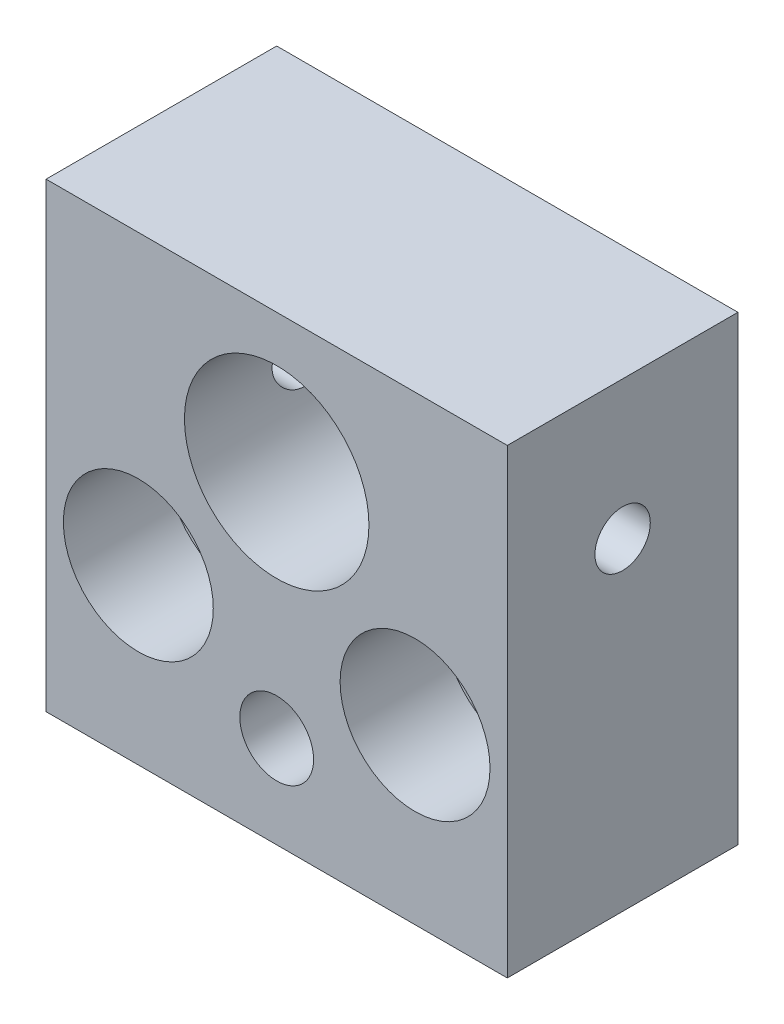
SolidWorks part; units mm, degrees
ref_plane "Face" through (0, 0, 0) normal (0, 0, 1) x (1, 0, 0)
ref_plane "Dessus" through (0, 0, 0) normal (0, 1, 0) x (1, 0, 0)
ref_plane "Droite" through (0, 0, 0) normal (1, 0, 0) x (0, 0, -1)
sketch "Esquisse1" plane through (0, 0, 0) normal (0, 0, 1) x (1, 0, 0)
  line L1 (-10, 38.5) -> (10, 38.5)
  line L2 (-10, 38.5) -> (-10, 18.5)
  line L3 (-10, 18.5) -> (10, 18.5)
  line L4 (10, 38.5) -> (10, 18.5)
  arc A0 (2, 27.9174) -> (-2, 27.9174) centre (0, 32.5) ccw construction
  circle A1 centre (0, 32.5) radius 4
  dimension "D3" = 10
  dimension "D5" = 8
  dimension "D1" = 6
  dimension "D2" = 20
  dimension "D4" = 20
extrude "Extrusion1" add sketch "Esquisse1" along normal blind 10
hole_wizard "Chambrage pour vis à tête cylindrique à 6 pans creux (vis CHC) M31" positions "Esquisse3" profile "Esquisse2" counterbore size "M3" standard "ISO"
sketch "Esquisse3" plane through (0, 0, 10) normal (0, 0, 1) x (1, 0, 0)
  circle A0 centre (-6, 26) radius 1.2 construction
  circle A1 centre (6, 26) radius 1.2 construction
  point P0 (-6, 26)
  point P1 (6, 26)
sketch "Esquisse2" plane through (-6, 26, 10) normal (1, 0, 0) x (0, -1, 0)
  line L0 (0, 0) -> (0, 10)
  line L1 (0, 10) -> (1.7, 10)
  line L3 (1.7, 10) -> (1.7, 4.5)
  line L4 (1.7, 4.5) -> (3.25, 4.5)
  line L5 (3.25, 4.5) -> (3.25, 0)
  line L7 (3.25, 0) -> (0, 0)
  line L11 (0, -6.35) -> (0, 107.95) construction
  dimension "Diamètre du perçage jusqu'au prochain" = 3.4
  dimension "Profondeur du perçage jusqu'au prochain" = 10
  dimension "Diamètre du chambrage" = 6.5
  dimension "Profondeur du chambrage" = 4.5
hole_wizard "Trou taraudé M4x0.71" positions "Esquisse5" profile "Esquisse4" tap size "M4x0.7" standard "ISO"
sketch "Esquisse5" plane through (0, 0, 10) normal (0, 0, 1) x (1, 0, 0)
  line L0 (0, 32.5) -> (0, 9.3996) construction
  line L1 (-10, 18.5) -> (10, 18.5) construction
  point P0 (0, 22.5)
  dimension "D1" = 4
sketch "Esquisse4" plane through (0, 22.5, 10) normal (1, 0, 0) x (0, -1, 0)
  line L0 (0, 0) -> (0, 10)
  line L1 (0, 10) -> (1.6, 10)
  line L2 (1.6, 10) -> (1.6, 0)
  line L5 (1.6, 0) -> (0, 0)
  line L11 (0, -6.35) -> (0, 107.95) construction
  dimension "Diamètre du trou pour taraudage jusqu'au prochain" = 3.2
  dimension "Profondeur du trou pour taraudage jusqu'au prochain" = 10
hole_wizard "Trou taraudé M3x0.51" positions "Esquisse8" profile "Esquisse7" tap size "M3x0.5" standard "ISO"
sketch "Esquisse8" plane through (10, 0, 0) normal (1, 0, 0) x (0, 0, -1)
  line L0 (-15.2716, 32.5) -> (8.7675, 32.5) construction
  line L1 (-10, 38.5) -> (0, 38.5) construction
  line L2 (-10, 18.5) -> (-10, 38.5) construction
  point P0 (-5, 32.5)
  dimension "D1" = 6
  dimension "D2" = 5
sketch "Esquisse7" plane through (10, 32.5, 5) normal (0, 1, 0) x (0, 0, -1)
  line L0 (0, 0) -> (0, 20)
  line L1 (0, 20) -> (1.2, 20)
  line L2 (1.2, 20) -> (1.2, 0)
  line L5 (1.2, 0) -> (0, 0)
  line L11 (0, -6.35) -> (0, 107.95) construction
  dimension "Diamètre du trou pour taraudage jusqu'au prochain" = 2.4
  dimension "Profondeur du trou pour taraudage jusqu'au prochain" = 20
